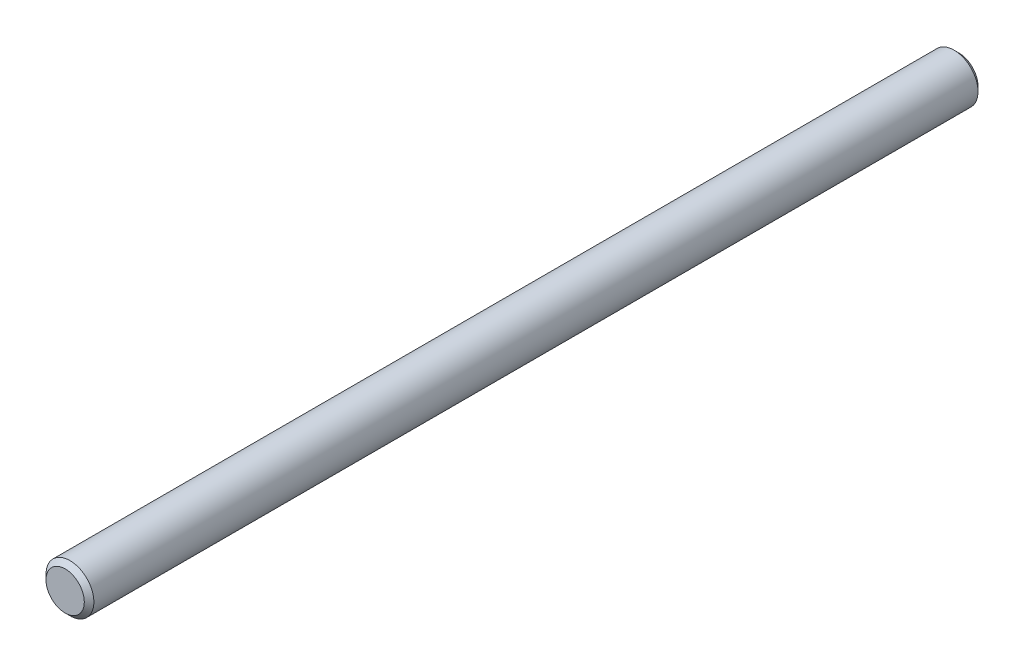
SolidWorks part; units mm, degrees
ref_plane "Plan de face" through (0, 0, 0) normal (0, 0, 1) x (1, 0, 0)
ref_plane "Plan de dessus" through (0, 0, 0) normal (0, 1, 0) x (1, 0, 0)
ref_plane "Plan de droite" through (0, 0, 0) normal (1, 0, 0) x (0, 0, -1)
sketch "Esquisse1" plane through (0, 0, 0) normal (0, 0, 1) x (1, 0, 0)
  circle A0 centre (0, 0) radius 1.5
extrude "Extrusion1" add sketch "Esquisse1" along normal blind 56
chamfer "Chanfrein1" distance 0.3 angle 45 2 edges at (1.5, 0, 0) (1.5, 0, 56)
